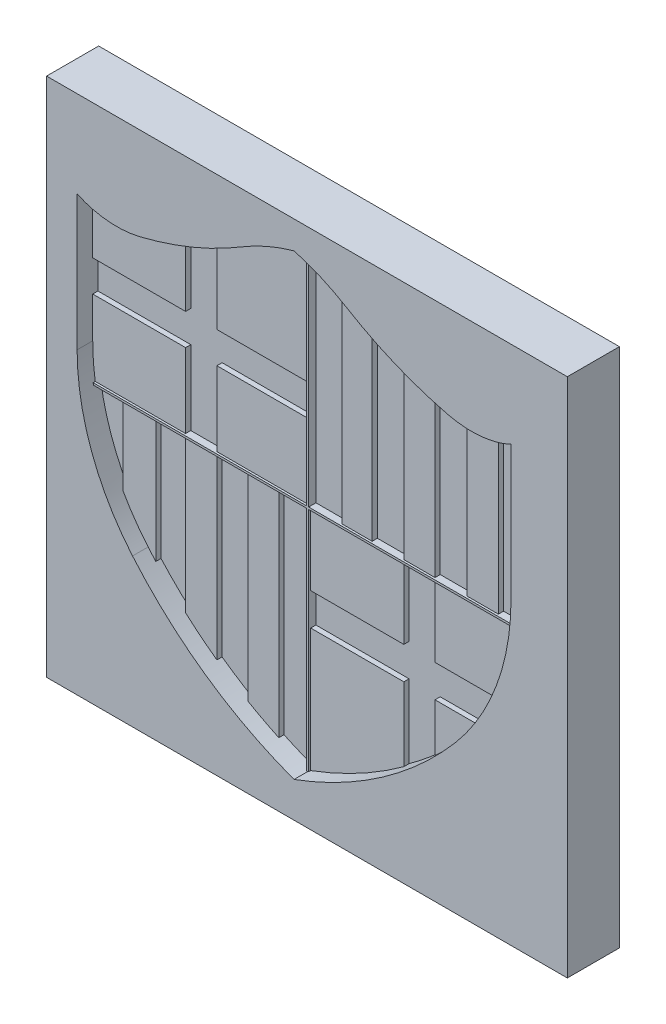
SolidWorks part; units mm, degrees
ref_plane "Alzado" through (0, 0, 0) normal (0, 0, 1) x (1, 0, 0)
ref_plane "Planta" through (0, 0, 0) normal (0, 1, 0) x (1, 0, 0)
ref_plane "Vista lateral" through (0, 0, 0) normal (1, 0, 0) x (0, 0, -1)
sketch "Croquis1" plane through (0, 0, 0) normal (0, 0, 1) x (1, 0, 0)
  line L1 (-182.9051, 200.6757) -> (317.0949, 200.6757)
  line L2 (-182.9051, 200.6757) -> (-182.9051, -299.3243)
  line L3 (-182.9051, -299.3243) -> (317.0949, -299.3243)
  line L4 (317.0949, 200.6757) -> (317.0949, -299.3243)
  dimension "D1" = 500
  dimension "D2" = 500
extrude "Saliente-Extruir1" add sketch "Croquis1" along normal blind 50
other "Cavidad1"
other "01.- MOLDEEDU<1>@Ensamblaje1"
